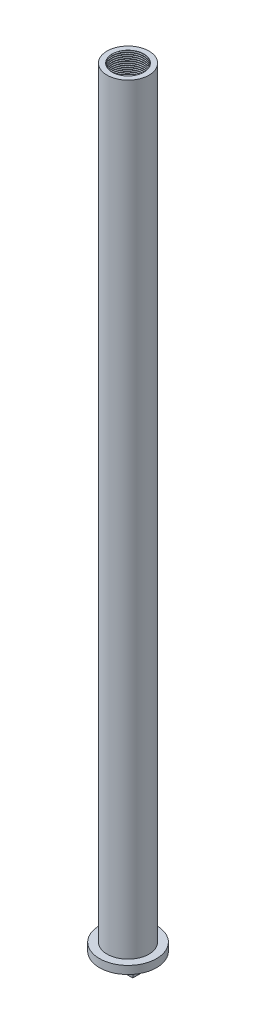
SolidWorks part; units mm, degrees
ref_plane "Front Plane" through (0, 0, 0) normal (0, 0, 1) x (1, 0, 0)
ref_plane "Top Plane" through (0, 0, 0) normal (0, 1, 0) x (1, 0, 0)
ref_plane "Right Plane" through (0, 0, 0) normal (1, 0, 0) x (0, 0, -1)
sketch "Sketch2" plane through (0, 0, 0) normal (0, 1, 0) x (1, 0, 0)
  line L0 (0, -7.874) -> (15.494, 0) construction
  line L1 (0, 0) -> (15.494, 0)
  line L2 (0, 0) -> (0, -7.874)
  line L3 (0, -7.874) -> (15.494, -7.874)
  line L4 (15.494, 0) -> (15.494, -7.874)
  line L5 (0, 0) -> (15.494, -7.874) construction
  dimension "D1" = 15.494
  dimension "D2" = 7.874
ref_plane "Plane1" through (0, 12.7, 0) normal (0, -1, 0) x (-1, 0, 0)
sketch "Sketch4" plane through (0, 12.7, 0) normal (0, -1, 0) x (-1, 0, 0)
  line L0 (0, -7.874) -> (-15.494, 0) construction
  circle A0 centre (-7.747, -3.937) radius 10.16
  dimension "D1" = 20.32
loft "Loft1" add profiles "Sketch4", "Sketch2"
sketch "Sketch5" plane through (0, 12.7, 0) normal (0, -1, 0) x (-1, 0, 0)
  circle A1 centre (-7.747, -3.937) radius 22.86
  arc A2 (-16.8045, -8.54) -> (1.3105, -8.54) centre (-7.747, -3.937) ccw construction
  dimension "D1" = 45.72
extrude "Boss-Extrude1" add sketch "Sketch5" against normal blind 6.35
sketch "Sketch6" plane through (0, 19.05, 0) normal (0, 1, 0) x (1, 0, 0)
  circle A0 centre (7.747, -3.937) radius 16.764
  circle A1 centre (7.747, -3.937) radius 22.86 construction
  dimension "D1" = 33.528
extrude "Boss-Extrude2" add sketch "Sketch6" along normal blind 609.6
sketch "Sketch7" plane through (0, 628.65, 0) normal (0, 1, 0) x (1, 0, 0)
  circle A0 centre (7.747, -3.937) radius 12.7
  circle A1 centre (7.747, -3.937) radius 16.764 construction
  dimension "D1" = 25.4
extrude "Cut-Extrude1" cut sketch "Sketch7" against normal blind 45.72 contours A0
thread "Thread1" pitch 1.5 start angle 0, offset 0, length 45.72, pitch 1.5, diameter 25.4
ref_plane "Plane2" through (-4.953, 628.65, 3.937) normal (0, 0, 1) x (-1, 0, 0)
sketch "Thread Profile1" plane through (-4.953, 628.65, 3.937) normal (0, 0, 1) x (-1, 0, 0)
  line L0 (0, 0) -> (0, 1.5) construction
  line L1 (0, 0) -> (0.8119, 0.4687)
  line L2 (0.8119, 0.4687) -> (0.8119, 0.6562)
  line L3 (0.8119, 0.6562) -> (0, 1.125)
  line L4 (0.8119, 0.5625) -> (0, 0.5625) construction
  line L11 (0, 0) -> (0, 1.125)
  point P2 (0, 0)
  dimension "Pitch" = 1.5
  dimension "Profile_Angle" = 60
  dimension "Profile_Land" = 0.1875
  dimension "Profile_Height" = 0.8119
